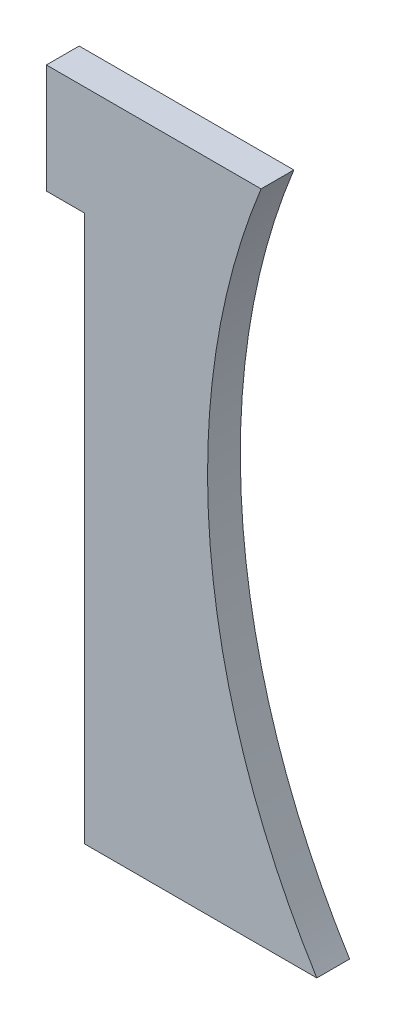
SolidWorks part; units mm, degrees
ref_plane "Plan de face" through (0, 0, 0) normal (0, 0, 1) x (1, 0, 0)
ref_plane "Plan de dessus" through (0, 0, 0) normal (0, 1, 0) x (1, 0, 0)
ref_plane "Plan de droite" through (0, 0, 0) normal (1, 0, 0) x (0, 0, -1)
sketch "Esquisse1" plane through (0, 0, 0) normal (0, 0, 1) x (1, 0, 0)
  line L0 (-225, -140) -> (-310, -140)
  line L1 (-310, -140) -> (-310, 60)
  line L2 (-310, 60) -> (-324, 60)
  line L3 (-324, 60) -> (-324, 100)
  line L4 (-324, 100) -> (-245.4078, 100)
  arc A0 (-245.4078, 100) -> (-225, -140) centre (0, 0) ccw
  dimension "D3" = 265
  dimension "D1" = 140
  dimension "D2" = 310
  dimension "D4" = 14
  dimension "D5" = 200
  dimension "D6" = 240
extrude "Extrusion1" add sketch "Esquisse1" along normal blind 12
